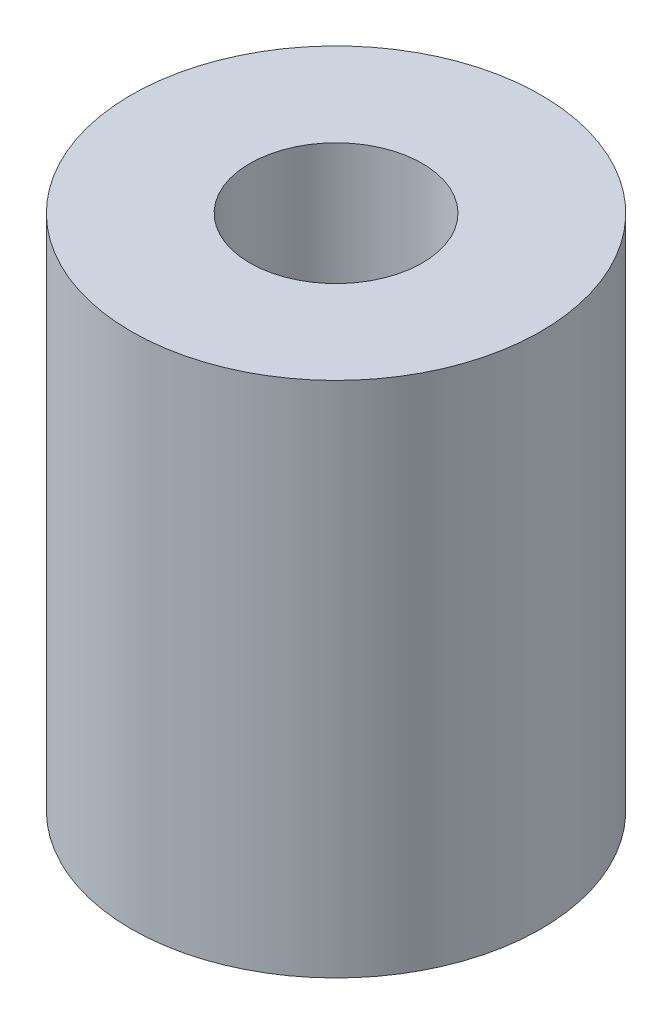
SolidWorks part; units mm, degrees
ref_plane "Plan de face" through (0, 0, 0) normal (0, 0, 1) x (1, 0, 0)
ref_plane "Plan de dessus" through (0, 0, 0) normal (0, 1, 0) x (1, 0, 0)
ref_plane "Plan de droite" through (0, 0, 0) normal (1, 0, 0) x (0, 0, -1)
sketch "Esquisse1" plane through (0, 0, 0) normal (0, 0, 1) x (1, 0, 0)
  line L0 (0, 16.2148) -> (0, -25.4996) construction
  line L1 (-12, 12) -> (12, 12) construction
  line L2 (4, 12) -> (9.5, 12)
  line L3 (4, 12) -> (4, -12)
  line L4 (4, -12) -> (9.5, -12)
  line L5 (9.5, 12) -> (9.5, -12)
  line L6 (12, -12) -> (-12, -12) construction
  line L7 (4, 12) -> (4, 15) construction
  dimension "D1" = 19
revolve "Révolution1" add sketch "Esquisse1" angle 360 about L0
